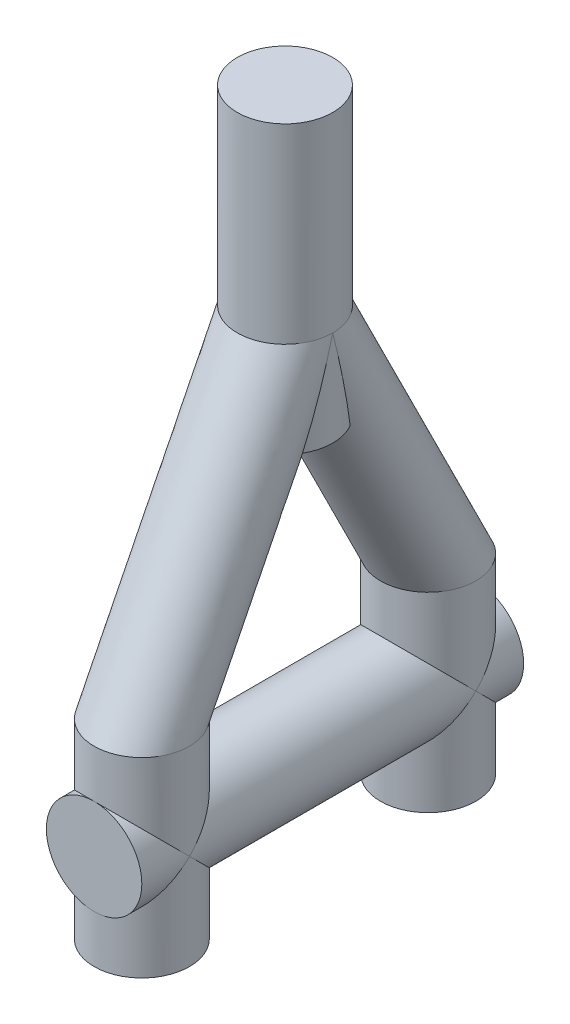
SolidWorks part; units mm, degrees
ref_plane "Plan de face" through (0, 0, 0) normal (0, 0, 1) x (1, 0, 0)
ref_plane "Plan de dessus" through (0, 0, 0) normal (0, 1, 0) x (1, 0, 0)
ref_plane "Plan de droite" through (0, 0, 0) normal (1, 0, 0) x (0, 0, -1)
sketch "Esquisse1" plane through (0, 0, 0) normal (0, 0, 1) x (1, 0, 0)
  circle A0 centre (0, 0) radius 2.5
  dimension "D1" = 5
extrude "Boss.-Extru.1" add sketch "Esquisse1" along normal mid plane 20
sketch "Esquisse2" plane through (0, 0, 0) normal (0, 1, 0) x (1, 0, 0)
  circle A0 centre (0, -7.5) radius 2.5
  circle A1 centre (0, 7.5) radius 2.5
  dimension "D1" = 7.5
  dimension "D2" = 7.5
extrude "Boss.-Extru.2" add sketch "Esquisse2" along normal mid plane 10
sketch "Esquisse3" plane through (0, 0, 0) normal (1, 0, 0) x (0, 0, -1)
  line L0 (7.5, 5) -> (0, 20)
  line L1 (-7.5, 5) -> (0, 20)
  dimension "D1" = 15
sketch "Esquisse4" plane through (0, 5, 0) normal (0, 1, 0) x (1, 0, 0)
  circle A0 centre (0, -7.5) radius 2.5 construction
  circle A1 centre (0, -7.5) radius 2.5
sweep "Balayage1" add profiles "Esquisse4" path "Esquisse3"
sketch "Esquisse5" plane through (0, 1, 0.5) normal (0, -0.8944, -0.4472) x (1, 0, 0)
  line L1 (2.5, -8.9446) -> (-2.5, -8.9392)
  line L2 (2.5, -8.9446) -> (-2.5, -8.9392)
  spline S1 degree 3 poles (-2288.2581, -3278.0866) (405.2013, 68.6193) (-10.3269, 13.0099) (-2.3069, -9.8373) (-2.1876, -10.0583) (-1.9252, -10.3769) (-1.8234, -10.481) (-1.5848, -10.6798) (-1.4489, -10.7742) (-1.1262, -10.9477) (-0.9398, -11.0263) (-0.6123, -11.1146) (-0.4974, -11.1384) (-0.2555, -11.1713) (-0.1275, -11.1803) (0, -11.1803) (0.1275, -11.1803) (0.251, -11.1717) (0.4913, -11.1394) (0.608, -11.1155) (0.8238, -11.0579) (0.9254, -11.0235) (1.1133, -10.9485) (1.1995, -10.9079) (1.4407, -10.7794) (1.5789, -10.684) (1.8179, -10.4861) (1.9198, -10.3826) (2.1826, -10.0659) (2.3027, -9.8457) (2.4613, -9.4006) (2.4994, -9.1751) (2.5551, 11.1698) (-295.9193, 31.8745) (-3483.7797, -1959.4782) knots -5.523685 -5.523685 -5.523685 -5.523685 0.81194 0.81194 0.87444 0.87444 0.90569 0.90569 0.93694 0.93694 0.96819 0.96819 0.983815 0.983815 0.99944 0.99944 0.99944 1.015065 1.015065 1.03069 1.03069 1.046315 1.046315 1.06194 1.06194 1.09319 1.09319 1.12444 1.12444 1.18694 1.18694 1.24944 1.24944 6.828314 6.828314 6.828314 6.828314 only from (-2.5, -8.9392) to (2.5, -8.9446)
  spline S2 degree 3 poles (-2.5, -8.9392) (-2.5006, -9.1652) (-2.4634, -9.3912) (-2.3069, -9.8373) (-2.1876, -10.0583) (-1.9252, -10.3769) (-1.8234, -10.481) (-1.5848, -10.6798) (-1.4489, -10.7742) (-1.1262, -10.9477) (-0.9398, -11.0263) (-0.6123, -11.1146) (-0.4974, -11.1384) (-0.2555, -11.1713) (-0.1275, -11.1803) (0, -11.1803) (0.1275, -11.1803) (0.251, -11.1717) (0.4913, -11.1394) (0.608, -11.1155) (0.8238, -11.0579) (0.9254, -11.0235) (1.1133, -10.9485) (1.1995, -10.9079) (1.4407, -10.7794) (1.5789, -10.684) (1.8179, -10.4861) (1.9198, -10.3826) (2.1826, -10.0659) (2.3027, -9.8457) (2.4613, -9.4006) (2.4994, -9.1751) (2.5, -8.948) (2.5, -8.9463) (2.5, -8.9446) knots 0.749529 0.749529 0.749529 0.749529 0.81194 0.81194 0.87444 0.87444 0.90569 0.90569 0.93694 0.93694 0.96819 0.96819 0.983815 0.983815 0.99944 0.99944 0.99944 1.015065 1.015065 1.03069 1.03069 1.046315 1.046315 1.06194 1.06194 1.09319 1.09319 1.12444 1.12444 1.18694 1.18694 1.24944 1.24944 1.249911 1.249911 1.249911 1.249911
  dimension "D1" = 0
extrude "Boss.-Extru.3" add sketch "Esquisse5" along normal up to surface (0.0002 mm away)
ref_plane "Plan1" through (0, 15, 0) normal (0, 1, 0) x (-1, 0, 0)
sketch "Esquisse6" plane through (0, 15, 0) normal (0, 1, 0) x (-1, 0, 0)
  circle A0 centre (0, 0) radius 2.5
  dimension "D1" = 5
extrude "Boss.-Extru.4" add sketch "Esquisse6" along normal blind 15
